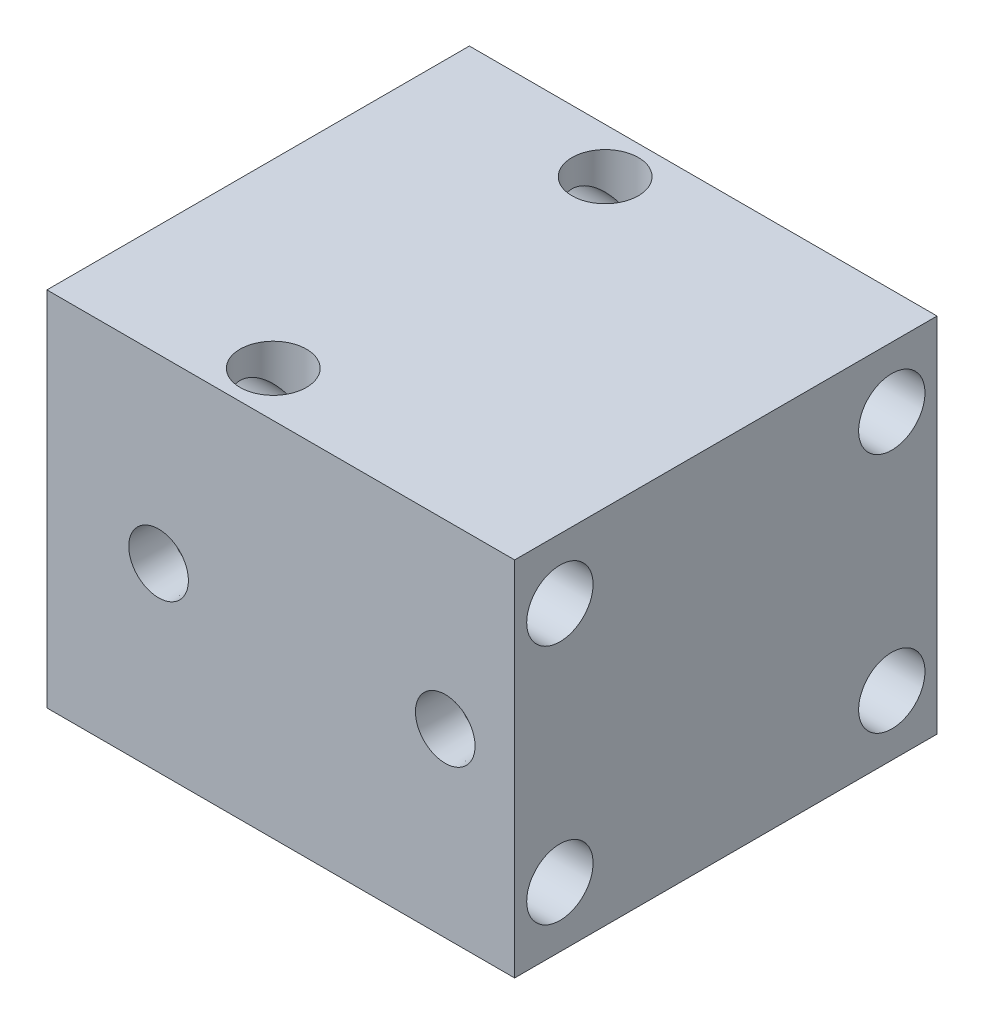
SolidWorks part; units mm, degrees
ref_plane "Front Plane" through (0, 0, 0) normal (0, 0, 1) x (1, 0, 0)
ref_plane "Top Plane" through (0, 0, 0) normal (0, 1, 0) x (1, 0, 0)
ref_plane "Right Plane" through (0, 0, 0) normal (1, 0, 0) x (0, 0, -1)
sketch "Sketch1" plane through (0, 0, 0) normal (0, 1, 0) x (1, 0, 0)
  line L0 (-17.5, 55) -> (-17.5, -55) construction
  line L1 (-77.5, 70) -> (77.5, 70)
  line L2 (-77.5, 70) -> (-77.5, -70)
  line L3 (-77.5, -70) -> (77.5, -70)
  line L4 (77.5, 70) -> (77.5, -70)
  line L5 (-77.5, 0) -> (-17.5, 0) construction
  circle A0 centre (-17.5, 55) radius 11
  circle A1 centre (-17.5, -55) radius 11
  dimension "D5" = 22
  dimension "D6" = 22
  dimension "D8" = 60
  dimension "D1" = 140
  dimension "D2" = 70
  dimension "D3" = 155
  dimension "D4" = 77.5
  dimension "D7" = 110
extrude "H1" add sketch "Sketch1" along normal blind 120
sketch "Sketch2" plane through (-77.5, 0, 0) normal (-1, 0, 0) x (0, 0, 1)
  line L0 (0, 0) -> (0, 60) construction
  line L1 (70, 60) -> (0, 60) construction
  line L2 (70, 120) -> (70, 0) construction
  circle A0 centre (0, 60) radius 1.5
  dimension "D1" = 3
extrude "CENTER HOLE" cut sketch "Sketch2" against normal blind 60
hole_wizard "1/2 NPT Tapped Hole1" positions "Sketch4" profile "Sketch3" size "1/2" standard "Ansi Inch"
sketch "Sketch4" plane through (0, 0, 70) normal (0, 0, 1) x (1, 0, 0)
  line L0 (-77.5, 60) -> (77.5, 60) construction
  line L1 (-77.5, 120) -> (-77.5, 0) construction
  line L2 (77.5, 120) -> (77.5, 0) construction
  point P0 (54.5, 60)
  point P1 (-40.5, 60)
  dimension "D1" = 37
  dimension "D2" = 23
sketch "Sketch3" plane through (54.5, 60, 70) normal (1, 0, 0) x (0, -1, 0)
  line L0 (0, 0) -> (0, 28.0045)
  line L1 (8.9281, 22.64) -> (0, 28.0045)
  line L2 (-8.9281, 22.64) -> (0, 28.0045) construction
  line L3 (8.9281, 22.64) -> (8.9281, 13.57)
  line L4 (8.9281, 13.57) -> (9.4797, 13.57)
  line L5 (9.4797, 13.57) -> (9.886, 0)
  line L6 (-9.4797, 13.57) -> (-9.886, 0) construction
  line L7 (9.886, 0) -> (0, 0)
  line L8 (0, -6.35) -> (0, 107.95) construction
  line L11 (-8.9281, 13.57) -> (-9.4797, 13.57) construction
  dimension "Tap Drill Dia." = 17.8562
  dimension "Tap Drill Depth" = 22.64
  dimension "Thread Dia." = 19.772
  dimension "Thread Angle" = 3.43
  dimension "Thread Depth" = 13.57
  dimension "Drill Angle" = 118
sketch "Sketch6" plane through (-77.5, 0, 0) normal (-1, 0, 0) x (0, 0, 1)
  line L0 (-55, 120) -> (-55, 0) construction
  line L1 (55, 120) -> (55, 0) construction
  line L3 (-55, 100) -> (55, 100) construction
  line L5 (-55, 20) -> (55, 20) construction
  circle A0 centre (-55, 100) radius 11
  circle A1 centre (-55, 20) radius 11
  circle A2 centre (55, 100) radius 11
  circle A3 centre (55, 20) radius 11
  dimension "D3" = 22
  dimension "D1" = 40
  dimension "D2" = 80
extrude "MTG HOLE" cut sketch "Sketch6" against normal up to surface (155 mm away)
sketch "Sketch5" plane through (0, 0, 70) normal (0, 0, 1) x (1, 0, 0)
  circle A0 centre (-40.5, 60) radius 2
  circle A1 centre (54.5, 60) radius 2
  circle A2 centre (54.5, 60) radius 9.886 construction
  circle A3 centre (-40.5, 60) radius 9.886 construction
  dimension "D1" = 4
  dimension "D2" = 4
extrude "OIL HOLE" cut sketch "Sketch5" against normal blind 30
equation "\"D1@Sketch6\"=\"D2@Sketch6\"/2"
equation "\"D5@Sketch1\" = \"D6@Sketch1\""
equation "\"D2@Sketch1\" = \"D1@Sketch1\"/2"
equation "\"D4@Sketch1\"=\"D3@Sketch1\" / 2"
